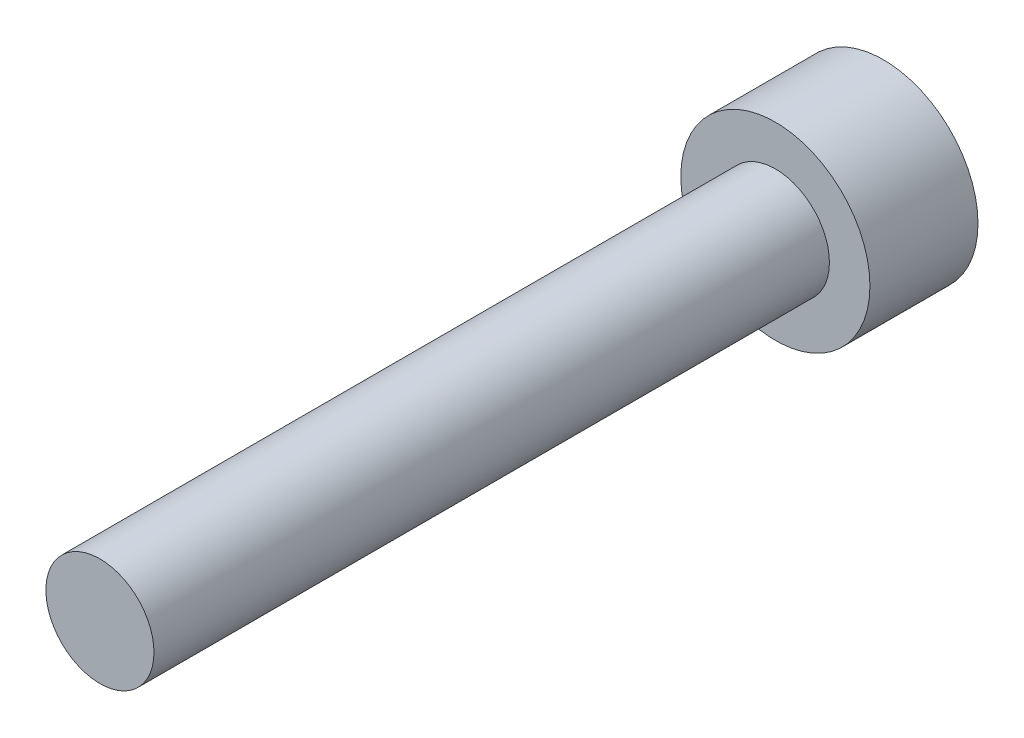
SolidWorks part; units mm, degrees
ref_plane "Front Plane" through (0, 0, 0) normal (0, 0, 1) x (1, 0, 0)
ref_plane "Top Plane" through (0, 0, 0) normal (0, 1, 0) x (1, 0, 0)
ref_plane "Right Plane" through (0, 0, 0) normal (1, 0, 0) x (0, 0, -1)
sketch "Sketch6" plane through (0, 0, 0) normal (1, 0, 0) x (0, 0, -1)
  line L0 (-25, 0) -> (22.525, 0) construction
  line L1 (3.85, 0) -> (-3.85, 0) construction
  line L2 (-25, 0) -> (-25, -2)
  line L3 (-25, -2) -> (0, -2)
  line L4 (0, 3.85) -> (0, -3.85) construction
  line L5 (0, -2) -> (0, -3.5)
  line L6 (0, -3.5) -> (4, -3.5)
  line L7 (4, -3.5) -> (4, 0)
  line L8 (4, 0) -> (-25, 0)
  dimension "L" = 25
  dimension "H" = 4
  dimension "A" = 7
  dimension "D" = 4
revolve "Revolve1" add sketch "Sketch6" angle 360 about L0
sketch "Sketch7" plane through (0, 0, -4) normal (0, 0, -1) x (-1, 0, 0)
  line L2 (-1.5, 0.866) -> (-1.5, -0.866)
  line L4 (-1.5, -0.866) -> (0, -1.7321)
  line L5 (0, -1.7321) -> (1.5, -0.866)
  line L6 (1.5, -0.866) -> (1.5, 0.866)
  line L7 (1.5, 0.866) -> (0, 1.7321)
  line L8 (0, 1.7321) -> (-1.5, 0.866)
  circle A0 centre (0, 0) radius 1.5 construction
  dimension "J" = 3
extrude "HEX" cut sketch "Sketch7" against normal blind 3
